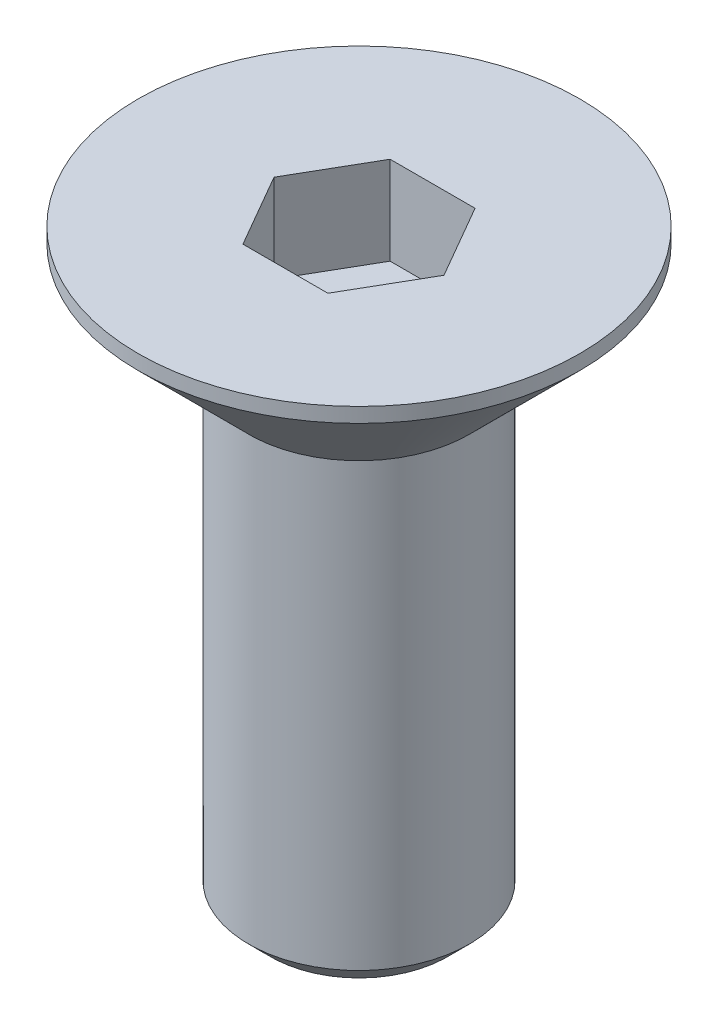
SolidWorks part; units mm, degrees
ref_plane "Face" through (0, 0, 0) normal (0, 0, 1) x (1, 0, 0)
ref_plane "Dessus" through (0, 0, 0) normal (0, 1, 0) x (1, 0, 0)
ref_plane "Droite" through (0, 0, 0) normal (1, 0, 0) x (0, 0, -1)
sketch "Esquisse1" plane through (0, 0, 0) normal (0, 0, 1) x (1, 0, 0)
  line L0 (0, 0) -> (0, 39.337) construction
  line L1 (0, 0) -> (1.5, 0)
  line L2 (1.5, 0) -> (1.5, 6.3)
  line L3 (1.5, 6.3) -> (3, 7.8)
  line L4 (3, 7.8) -> (3, 8)
  line L5 (3, 8) -> (0, 8)
  line L6 (0, 0) -> (0, 8)
  dimension "D1" = 3
  dimension "D2" = 45
  dimension "D3" = 6
  dimension "D4" = 1.7
  dimension "D5" = 8
revolve "Révolution1" add sketch "Esquisse1" angle 360 about L0
chamfer "Chanfrein1" distance 0.3 angle 45 1 edges at (0, 0, -1.5)
sketch "Esquisse2" plane through (0, 8, 0) normal (0, 1, 0) x (-1, 0, 0)
  line L1 (-0.5774, 1) -> (-1.1547, 0)
  line L2 (-1.1547, 0) -> (-0.5774, -1)
  line L3 (-0.5774, -1) -> (0.5774, -1)
  line L4 (0.5774, -1) -> (1.1547, 0)
  line L5 (1.1547, 0) -> (0.5774, 1)
  line L6 (0.5774, 1) -> (-0.5774, 1)
  circle A0 centre (0, 0) radius 1 construction
  dimension "D1" = 2
extrude "Enlèv. mat.-Extru.1" cut sketch "Esquisse2" against normal blind 1.2
